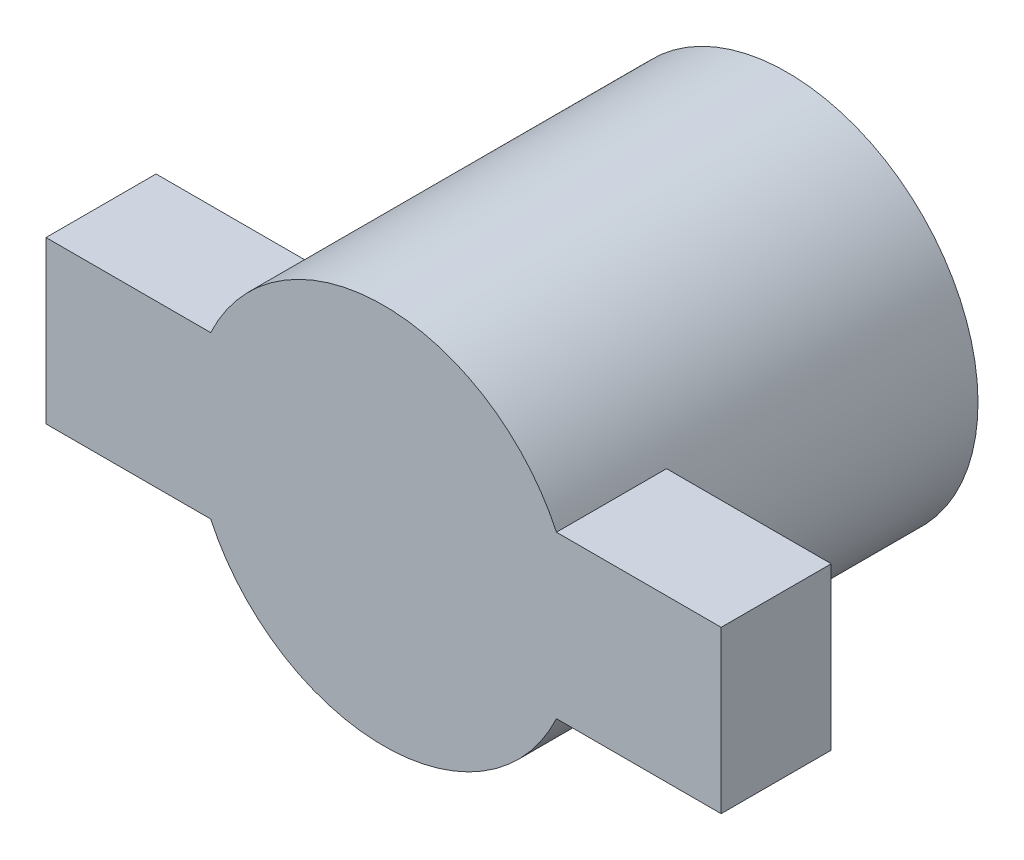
SolidWorks part; units mm, degrees
ref_plane "Front Plane" through (0, 0, 0) normal (0, 0, 1) x (1, 0, 0)
ref_plane "Top Plane" through (0, 0, 0) normal (0, 1, 0) x (1, 0, 0)
ref_plane "Right Plane" through (0, 0, 0) normal (1, 0, 0) x (0, 0, -1)
sketch "Sketch1" plane through (0, 0, 0) normal (0, 0, 1) x (1, 0, 0)
  line L12 (41.312, -4.863) -> (38.4619, -4.863)
  line L13 (41.312, -7.657) -> (41.312, -4.863)
  line L14 (38.4619, -7.657) -> (41.312, -7.657)
  line L15 (29.628, -7.657) -> (32.4781, -7.657)
  line L16 (29.628, -4.863) -> (29.628, -7.657)
  line L17 (32.4781, -4.863) -> (29.628, -4.863)
  line L18 (41.312, -4.863) -> (38.4619, -4.863)
  line L19 (41.312, -7.657) -> (41.312, -4.863)
  line L20 (38.4619, -7.657) -> (41.312, -7.657)
  line L21 (29.628, -7.657) -> (32.4781, -7.657)
  line L22 (29.628, -4.863) -> (29.628, -7.657)
  line L23 (32.4781, -4.863) -> (29.628, -4.863)
  arc A4 (38.4619, -4.863) -> (32.4781, -4.863) centre (35.47, -6.26) ccw
  arc A5 (32.4781, -7.657) -> (38.4619, -7.657) centre (35.47, -6.26) ccw
  arc A6 (38.4619, -4.863) -> (32.4781, -4.863) centre (35.47, -6.26) ccw
  arc A7 (32.4781, -7.657) -> (38.4619, -7.657) centre (35.47, -6.26) ccw
  dimension "D1" = 0.508
extrude "Boss-Extrude1" add sketch "Sketch1" against normal up to surface (1.905 mm away)
sketch "Sketch2" plane through (0, 0, -1.905) normal (0, 0, -1) x (-1, 0, 0)
  circle A0 centre (-35.47, -6.26) radius 3.302
extrude "Boss-Extrude2" add sketch "Sketch2" along normal blind 5.08
